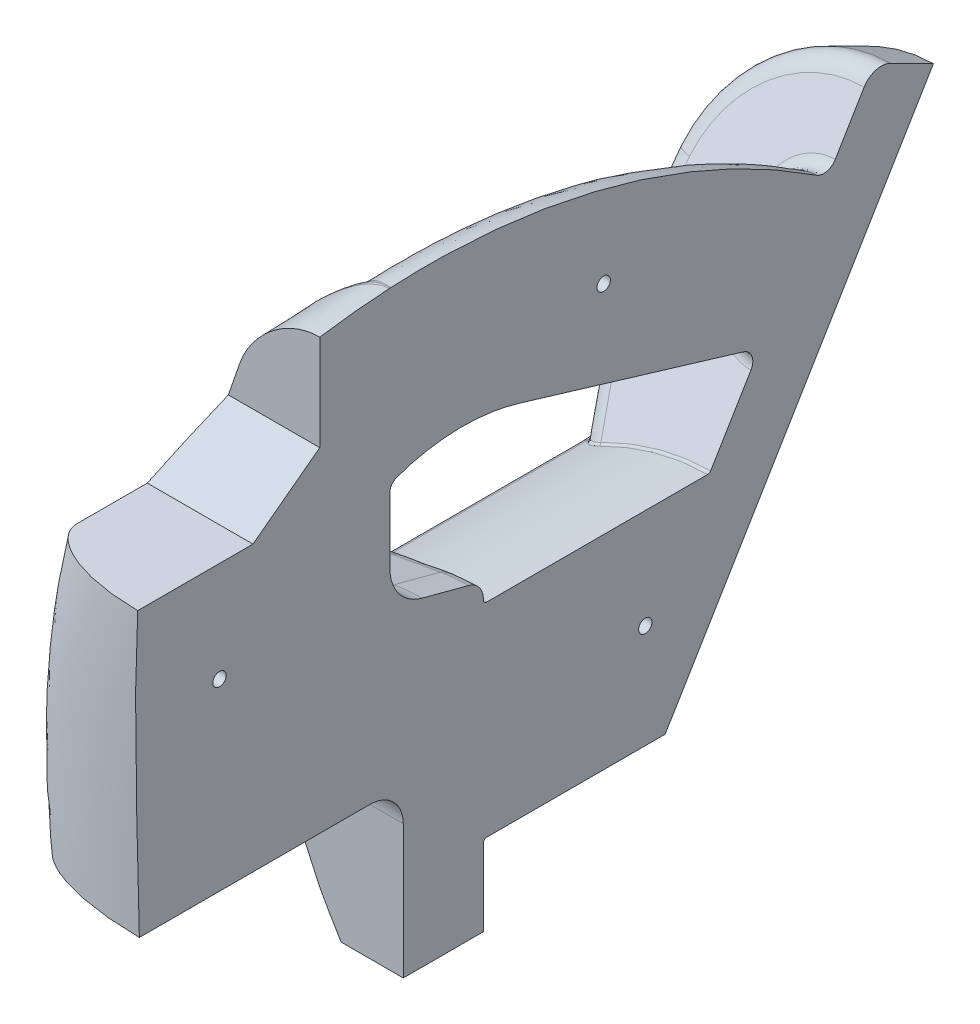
SolidWorks part; units mm, degrees
ref_plane "Front" through (0, 0, 0) normal (0, 0, 1) x (1, 0, 0)
ref_plane "Top" through (0, 0, 0) normal (0, 1, 0) x (1, 0, 0)
ref_plane "Right" through (0, 0, 0) normal (1, 0, 0) x (0, 0, -1)
imported_body "Imported_STEP"
sketch "Sketch1" plane through (0, 0, 0) normal (1, 0, 0) x (0, 0, -1)
  line L0 (-4.4961, 135) -> (30, 135)
  line L1 (30, 135) -> (50, 150)
  line L2 (50, 150) -> (50, 178.6585)
  point P2 (-2.8305, 160)
  point P3 (0, 0)
  point P6 (70.9971, 180.8687)
  point P7 (9, 167.9021)
other "AlignGroup1" parameters "D1"=0, "D2"=30, "D3"=50, "D4"=0, "D5"=135, "D6"=150
other "AlignGroup2"
extrude "upper cut" cut sketch "Sketch1" against normal through all and the other way through all
sketch "Sketch2" plane through (0, 0, 0) normal (1, 0, 0) x (0, 0, -1)
  line L0 (-4.0084, 50) -> (65, 50)
  line L1 (75, 40) -> (75, 0)
  line L2 (0, 0) -> (98.9859, 0) construction
  arc A0 (65, 50) -> (75, 40) centre (65, 40) cw
  point P2 (-4.4961, 135)
  point P3 (0, 0)
  dimension "D1" = 10
  dimension "D2" = 75
  dimension "D3" = 50
extrude "lower cut" cut sketch "Sketch2" against normal through all and the other way through all flip side to cut
fillet "Fillet1" radius 6 2 edges at (-27.772, 157.6534, -210.3809) (-41.3634, 105.7393, -179.1878)
fillet "Fillet2" radius 4 3 edges at (-7.3123, 141.7613, -200.832) (-7.467, 112.296, -183.1275) (-12.4151, 128.4355, -192.8251)
fillet "Fillet3" radius 3 5 edges at (-5.033, 179.7342, -70.7495) (-9.5785, 176.0772, -70.1084) (-4.3388, 130.7035, -70.8132) (-11.0489, 136.0477, -69.861) (-13.5744, 164.0748, -69.4289)
fillet "Fillet4" radius 5 6 edges at (-4.7101, 180.1183, -70.7803) (-22.9586, 162.3716, -67.7418) (-37.8637, 96.426, -68.8458)
fillet "Fillet5" radius 1 5 edges at (-32.5682, 77.9725, -163.7678) (-14.9021, 83.5659, -165.8647)
fillet "Fillet6" radius 6 12 edges at (-38.5236, 75.4332, -183.3788) (-4.1966, 90.6465, -98.9859) (-21.4724, 87.743, -98.9859) (-37.3552, 83.3941, -98.9859) (-38.5218, 75.3303, -99.2641) (-33.4451, 32.8235, -99.4954)
sketch "Sketch3" plane through (0, 0, 0) normal (1, 0, 0) x (0, 0, -1)
  line L0 (147.4592, 65.0489) -> (147.4592, 45.098) construction
  circle A0 centre (147.4592, 55.0734) radius 2
  circle A1 centre (135, 150) radius 2
  circle A2 centre (20, 105) radius 2
other "AlignGroup3" parameters "D7"=19.6563, "D1"=0, "D2"=20, "D3"=135, "D4"=0, "D5"=105, "D6"=150
other "AlignGroup4"
extrude "Stand Offs" cut sketch "Sketch3" against normal up to next draft 3
